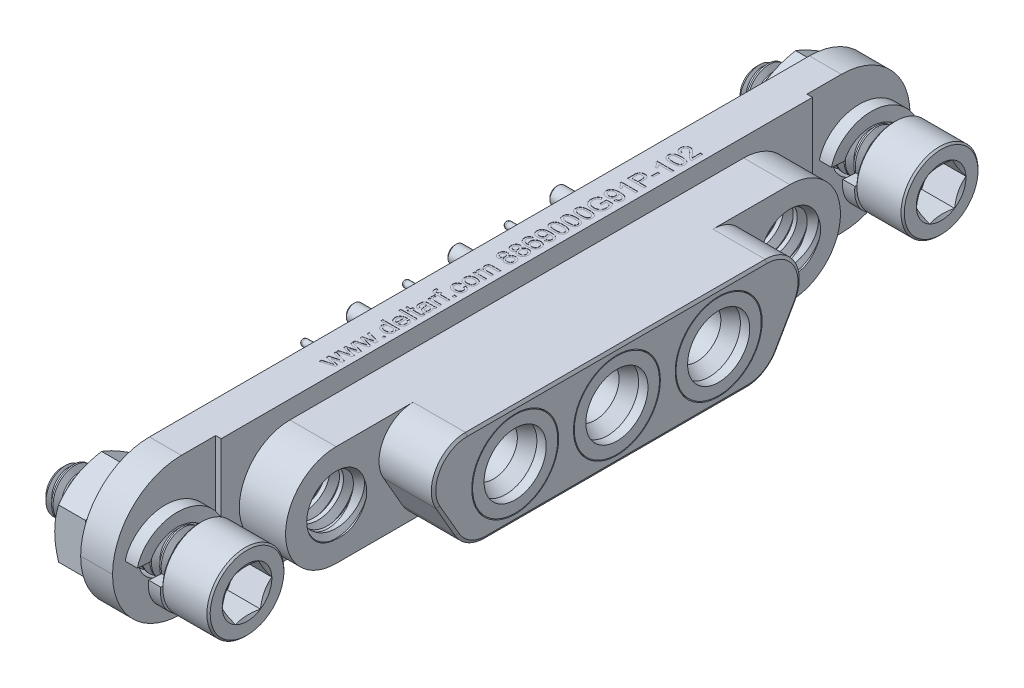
SolidWorks part; units mm, degrees
ref_plane "Front Plane" through (0, 0, 0) normal (0, 0, 1) x (1, 0, 0)
ref_plane "Top Plane" through (0, 0, 0) normal (0, 1, 0) x (1, 0, 0)
ref_plane "Right Plane" through (0, 0, 0) normal (1, 0, 0) x (0, 0, -1)
imported_body "21-196-1-solid1"
imported_body "57-485-1-solid1"
imported_body "57-485-2-solid1"
imported_body "44-1544-9-solid1"
imported_body "64-132-1-solid1"
imported_body "64-132-9-solid1"
imported_body "81-336-1-solid1"
imported_body "68-38-1-solid1"
imported_body "52-51-1-solid1"
imported_body "28-123-1-solid1"
imported_body "81-336-9-solid1"
imported_body "44-1544-17-solid1"
imported_body "28-123-4-solid1"
imported_body "52-51-3-solid1"
imported_body "68-38-4-solid1"
imported_body "53-71(1)-1-solid1"
imported_body "81-336-10-solid1"
imported_body "44-1544-18-solid1"
imported_body "57-485-3-solid1"
imported_body "64-132-10-solid1"
imported_body "64-132-11-solid1"
sketch "Sketch1" plane through (4.2418, 0, 0) normal (1, 0, 0) x (0, 0, -1)
  line L1 (11.577, 4.9023) -> (24.8996, 4.9023)
  line L2 (11.577, 4.9023) -> (11.577, 1.4035)
  line L3 (11.577, 1.4035) -> (24.8996, 1.4035)
  line L4 (24.8996, 4.9023) -> (24.8996, 1.4035)
extrude "Boss-Extrude1" add sketch "Sketch1" against normal up to surface (4.2418 mm away)
sketch "Sketch2" plane through (0, 6.35, 0) normal (0, 1, 0) x (1, 0, 0)
  line L0 (1.4686, 10.1242) -> (1.4686, 27.3834) construction
  text T0 "www.deltarf.com 8869000G91P-102" height in points 3
extrude "Cut-Extrude1" cut sketch "Sketch2" against normal blind 0.0102
